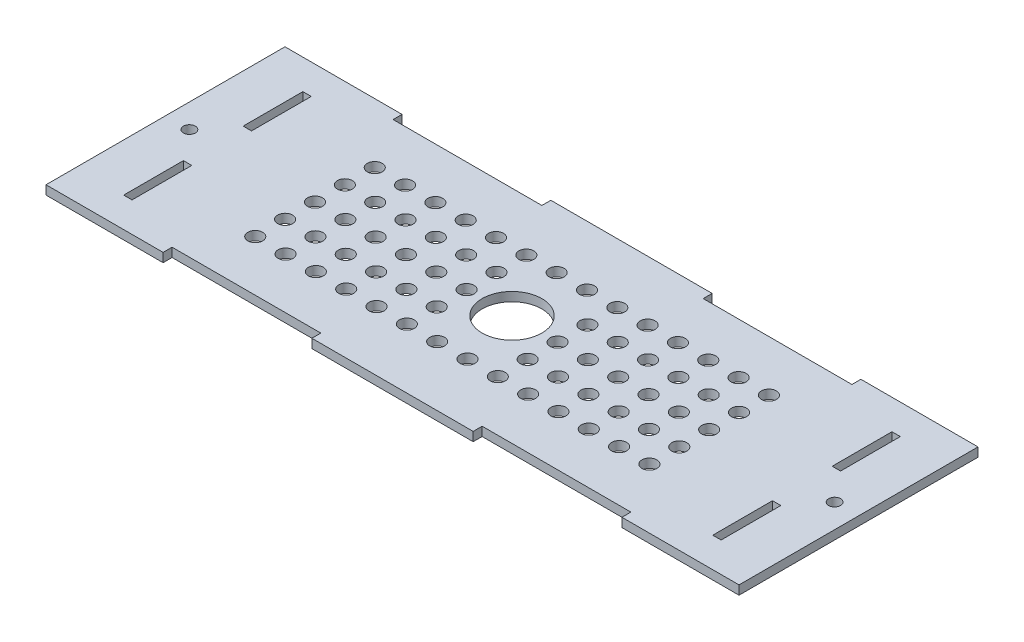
SolidWorks part; units mm, degrees
ref_plane "Front Plane" through (0, 0, 0) normal (0, 0, 1) x (1, 0, 0)
ref_plane "Top Plane" through (0, 0, 0) normal (0, 1, 0) x (1, 0, 0)
ref_plane "Right Plane" through (0, 0, 0) normal (1, 0, 0) x (0, 0, -1)
sketch "Sketch1" plane through (0, 0, 0) normal (0, 0, 1) x (1, 0, 0)
  line L0 (0, 0) -> (232, 0)
  dimension "D1" = 232
extrude "Extrude-Thin1" add sketch "Sketch1" along normal blind 80 thin
sketch "Sketch2" plane through (0, 0, 0) normal (0, 1, 0) x (1, 0, 0)
  line L0 (116, 0) -> (116, -80) construction
  line L1 (182, -80) -> (182, -60)
  line L2 (0, 0) -> (232, 0) construction
  line L3 (0, -80) -> (232, -80) construction
  line L4 (232, -40) -> (182, -40) construction
  line L5 (232, -80) -> (232, 0) construction
  line L6 (182, 0) -> (182, -80) construction
  line L7 (182, 0) -> (182, -20)
  line L8 (0, -40) -> (50, -40) construction
  line L9 (0, -80) -> (0, 0) construction
  line L10 (50, 0) -> (50, -80) construction
  circle A0 centre (116, -40) radius 10
  circle A1 centre (182, -20) radius 2.5
  circle A2 centre (171.85, -20) radius 2.5
  circle A3 centre (161.7, -20) radius 2.5
  circle A4 centre (151.55, -20) radius 2.5
  circle A5 centre (141.4, -20) radius 2.5
  circle A6 centre (131.25, -20) radius 2.5
  circle A7 centre (121.1, -20) radius 2.5
  circle A8 centre (110.95, -20) radius 2.5
  circle A9 centre (100.8, -20) radius 2.5
  circle A10 centre (90.65, -20) radius 2.5
  circle A11 centre (80.5, -20) radius 2.5
  circle A12 centre (70.35, -20) radius 2.5
  circle A13 centre (60.2, -20) radius 2.5
  circle A14 centre (50.05, -20) radius 2.5
  circle A15 centre (171.85, -30) radius 2.5
  circle A16 centre (161.7, -30) radius 2.5
  circle A17 centre (151.55, -30) radius 2.5
  circle A18 centre (141.4, -30) radius 2.5
  circle A19 centre (131.25, -30) radius 2.5
  circle A22 centre (100.8, -30) radius 2.5
  circle A23 centre (90.65, -30) radius 2.5
  circle A24 centre (80.5, -30) radius 2.5
  circle A25 centre (70.35, -30) radius 2.5
  circle A26 centre (60.2, -30) radius 2.5
  circle A27 centre (50.05, -30) radius 2.5
  circle A28 centre (171.85, -40) radius 2.5
  circle A29 centre (161.7, -40) radius 2.5
  circle A30 centre (151.55, -40) radius 2.5
  circle A31 centre (141.4, -40) radius 2.5
  circle A32 centre (131.25, -40) radius 2.5
  circle A35 centre (100.8, -40) radius 2.5
  circle A36 centre (90.65, -40) radius 2.5
  circle A37 centre (80.5, -40) radius 2.5
  circle A38 centre (70.35, -40) radius 2.5
  circle A39 centre (60.2, -40) radius 2.5
  circle A40 centre (50.05, -40) radius 2.5
  circle A41 centre (171.85, -50) radius 2.5
  circle A42 centre (161.7, -50) radius 2.5
  circle A43 centre (151.55, -50) radius 2.5
  circle A44 centre (141.4, -50) radius 2.5
  circle A45 centre (131.25, -50) radius 2.5
  circle A48 centre (100.8, -50) radius 2.5
  circle A49 centre (90.65, -50) radius 2.5
  circle A50 centre (80.5, -50) radius 2.5
  circle A51 centre (70.35, -50) radius 2.5
  circle A52 centre (60.2, -50) radius 2.5
  circle A53 centre (50.05, -50) radius 2.5
  circle A54 centre (171.85, -60) radius 2.5
  circle A55 centre (161.7, -60) radius 2.5
  circle A56 centre (151.55, -60) radius 2.5
  circle A57 centre (141.4, -60) radius 2.5
  circle A58 centre (131.25, -60) radius 2.5
  circle A59 centre (121.1, -60) radius 2.5
  circle A60 centre (110.95, -60) radius 2.5
  circle A61 centre (100.8, -60) radius 2.5
  circle A62 centre (90.65, -60) radius 2.5
  circle A63 centre (80.5, -60) radius 2.5
  circle A64 centre (70.35, -60) radius 2.5
  circle A65 centre (60.2, -60) radius 2.5
  circle A66 centre (50.05, -60) radius 2.5
  circle A67 centre (182, -30) radius 2.5
  circle A68 centre (182, -40) radius 2.5
  circle A69 centre (182, -50) radius 2.5
  circle A70 centre (182, -60) radius 2.5
  circle A71 centre (110.95, -30) radius 2.5
  circle A72 centre (121.1, -30) radius 2.5
  circle A73 centre (121.1, -40) radius 2.5
  circle A74 centre (110.95, -40) radius 2.5
  circle A75 centre (110.95, -50) radius 2.5
  circle A76 centre (121.1, -50) radius 2.5
  dimension "D1" = 50
  dimension "D3" = 20
  dimension "D2" = 20
  dimension "D4" = 50
  dimension "D5" = 14
  dimension "D6" = 5
extrude "Cut-Extrude1" cut sketch "Sketch2" against normal blind 10 contours A69 | A31 | A44 | A57 | A58 | A19 | A6 | A61 | A63 | A53 | A50 | A25 | A27 | A0 | A1 | A67 | A68 | A70 | A2 | A15 | A28 | A41 | A54 | A3 | A16 | A29 | A42 | A55 | A56 | A43 | A30 | A17 | A4 | A5 | A18 | A45 | A32 | A7 | A59 | A60 | A62 | A64 | A65 | A66 | A52 | A51 | A49 | A48 | A40 | A39 | A38 | A37 | A36 | A35 | A22 | A23 | A24 | A26 | A14 | A13 | A12 | A11 | A10 | A9 | A8
sketch "Sketch4" plane through (0, 0, 0) normal (0, 1, 0) x (1, 0, 0)
  line L0 (0, -40) -> (16, -40) construction
  line L1 (0, -80) -> (0, 0) construction
  line L2 (16, 0) -> (16, -10) construction
  line L3 (0, 0) -> (232, 0) construction
  line L4 (0, -40) -> (232, -40) construction
  line L5 (16, -10) -> (18.8, -10)
  line L6 (16, -10) -> (16, -30)
  line L7 (16, -30) -> (18.8, -30)
  line L8 (18.8, -10) -> (18.8, -30)
  line L9 (232, -80) -> (232, 0) construction
  line L10 (116, 0) -> (116, -80) construction
  line L11 (0, -80) -> (232, -80) construction
  line L12 (16, -80) -> (16, -70) construction
  line L13 (18.8, -70) -> (18.8, -50)
  line L14 (16, -50) -> (18.8, -50)
  line L15 (16, -70) -> (16, -50)
  line L16 (16, -70) -> (18.8, -70)
  line L17 (216, 0) -> (216, -10) construction
  line L18 (216, -10) -> (213.2, -10)
  line L19 (216, -80) -> (216, -70) construction
  line L20 (232, -40) -> (216, -40) construction
  line L21 (216, -70) -> (213.2, -70)
  line L22 (216, -70) -> (216, -50)
  line L23 (216, -50) -> (213.2, -50)
  line L24 (213.2, -70) -> (213.2, -50)
  line L25 (213.2, -10) -> (213.2, -30)
  line L26 (216, -30) -> (213.2, -30)
  line L27 (216, -10) -> (216, -30)
extrude "Cut-Extrude3" cut sketch "Sketch4" against normal blind 10
sketch "Sketch5" plane through (0, 0, 0) normal (0, 1, 0) x (1, 0, 0)
  line L0 (116, -80) -> (89, -80) construction
  line L1 (0, -80) -> (232, -80) construction
  line L2 (0, -40) -> (232, -40) construction
  line L3 (89, -80) -> (39.2, -80)
  line L4 (89, -80) -> (89, -77)
  line L5 (89, -77) -> (39.2, -77)
  line L6 (39.2, -80) -> (39.2, -77)
  line L7 (0, -80) -> (0, 0) construction
  line L8 (232, -80) -> (232, 0) construction
  line L9 (116, 0) -> (116, -80) construction
  line L10 (0, 0) -> (232, 0) construction
  line L11 (39.2, 0) -> (39.2, -3)
  line L12 (89, -3) -> (39.2, -3)
  line L13 (89, 0) -> (89, -3)
  line L14 (89, 0) -> (39.2, 0)
  line L15 (143, 0) -> (192.8, 0)
  line L16 (143, 0) -> (143, -3)
  line L17 (143, -3) -> (192.8, -3)
  line L18 (192.8, 0) -> (192.8, -3)
  line L19 (192.8, -80) -> (192.8, -77)
  line L20 (143, -77) -> (192.8, -77)
  line L21 (143, -80) -> (143, -77)
  line L22 (143, -80) -> (192.8, -80)
  dimension "D1" = 27
  dimension "D2" = 3
  dimension "D3" = 49.8
extrude "Cut-Extrude4" cut sketch "Sketch5" against normal blind 3
sketch "Sketch6" plane through (0, 0, 0) normal (0, 1, 0) x (1, 0, 0)
  line L0 (232, -40) -> (224, -40) construction
  line L1 (232, -80) -> (232, 0) construction
  line L2 (116, 0) -> (116, -80) construction
  line L3 (89, 0) -> (143, 0) construction
  line L4 (89, -80) -> (143, -80) construction
  line L6 (16, -30) -> (18.8, -30) construction
  line L9 (89, -80) -> (89, -77) construction
  circle A0 centre (224, -40) radius 2
  circle A1 centre (8, -40) radius 2
  dimension "D2" = 4
  dimension "D4" = 49.8
  dimension "D1" = 8
  dimension "D3" = 20
extrude "Cut-Extrude5" cut sketch "Sketch6" against normal blind 3
equation "\"thk\"= 2.8"
equation "\"D3@Sketch4\"=\"thk\""
